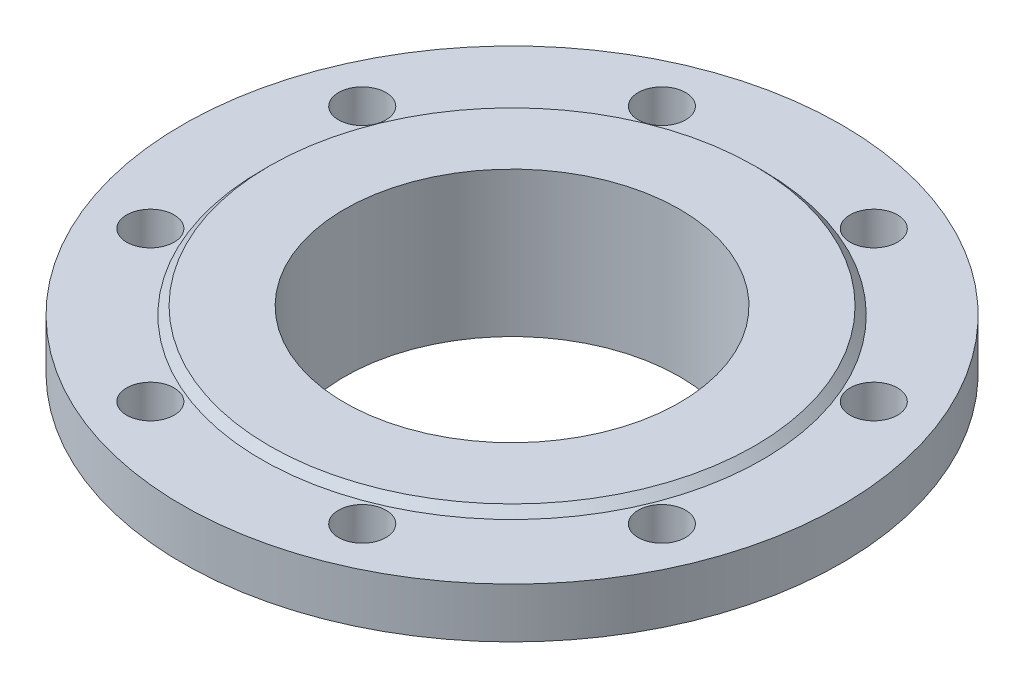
SolidWorks part; units mm, degrees
ref_plane "Plan de face" through (0, 0, 0) normal (0, 0, 1) x (1, 0, 0)
ref_plane "Plan de dessus" through (0, 0, 0) normal (0, 1, 0) x (1, 0, 0)
ref_plane "Plan de droite" through (0, 0, 0) normal (1, 0, 0) x (0, 0, -1)
sketch "Esquisse1" plane through (0, 0, 0) normal (0, 0, 1) x (1, 0, 0)
  line L0 (-400, 375) -> (-400, 491.8244) construction
  line L1 (-336.45, 375) -> (-463.55, 375) construction
  line L2 (-330.15, 375) -> (-330.15, 387)
  line L4 (-330.15, 387) -> (-321, 408)
  line L5 (-321, 408) -> (-275, 408)
  line L6 (-275, 408) -> (-275, 427)
  line L7 (-275, 427) -> (-305, 427)
  line L8 (-305, 427) -> (-308, 430)
  line L9 (-308, 430) -> (-336.45, 430)
  line L10 (-336.45, 430) -> (-336.45, 375)
  line L11 (-336.45, 375) -> (-330.15, 375)
  line L12 (-330.15, 375) -> (-469.85, 375) construction
  dimension "D1" = 12
  dimension "D2" = 250
  dimension "D3" = 184
  dimension "D4" = 3
  dimension "D5" = 3
  dimension "D6" = 55
  dimension "D7" = 22
  dimension "D8" = 158
  dimension "D9" = 6.3
  dimension "D10" = 139.7
revolve "Révolution1" add sketch "Esquisse1" angle 360 about L0
sketch "Esquisse2" plane through (0, 427, 0) normal (0, 1, 0) x (1, 0, 0)
  line L0 (-302.9926, 40.1818) -> (-400, 0) construction
  line L1 (-400, 0) -> (-275, 0) construction
  circle A0 centre (-302.9926, 40.1818) radius 9
  circle A1 centre (-400, 0) radius 125 construction
  circle A2 centre (-302.9926, -40.1818) radius 9
  circle A3 centre (-359.8182, -97.0074) radius 9
  circle A4 centre (-440.1818, -97.0074) radius 9
  circle A5 centre (-497.0074, -40.1818) radius 9
  circle A6 centre (-497.0074, 40.1818) radius 9
  circle A7 centre (-440.1818, 97.0074) radius 9
  circle A8 centre (-359.8182, 97.0074) radius 9
  dimension "D3" = 18
  dimension "D1" = 22.5
  dimension "D2" = 105
extrude "Enlèv. mat.-Extru.1" cut sketch "Esquisse2" against normal through all
